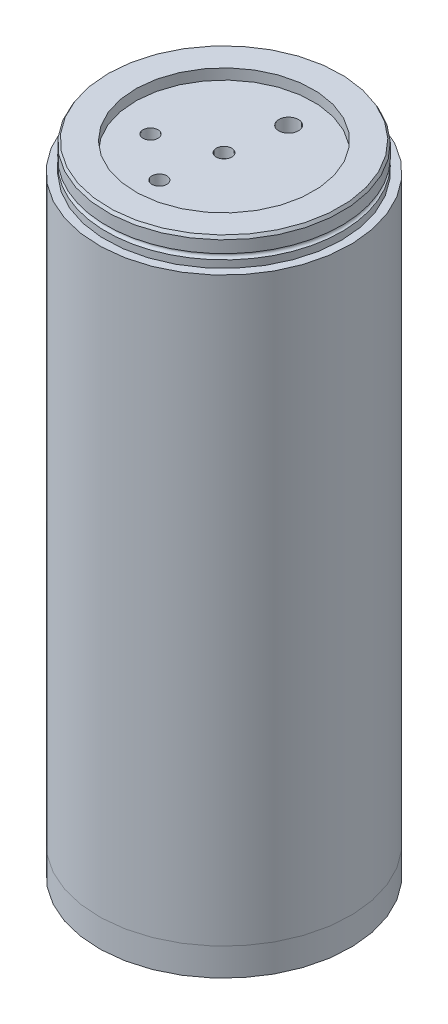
SolidWorks part; units mm, degrees
ref_plane "Front Plane" through (0, 0, 0) normal (0, 0, 1) x (1, 0, 0)
ref_plane "Top Plane" through (0, 0, 0) normal (0, 1, 0) x (1, 0, 0)
ref_plane "Right Plane" through (0, 0, 0) normal (1, 0, 0) x (0, 0, -1)
imported_body "Delrin Compute HousingPart-1-solid1"
imported_body "Delrin Compute HousingPart-1-solid2"
imported_body "Delrin Compute HousingPart-1-solid3"
imported_body "Delrin Compute HousingPart-1-solid4"
imported_body "ComputeNodeHousingPart-1-solid1"
imported_body "ComputeNodeHousingPart-1-solid2"
imported_body "ComputeNodeHousingPart-1-solid3"
imported_body "ComputeNodeHousingPart-1-solid4"
combine bodies "Combine2" operation type add bodies to combine 105 106 108 102 101 103 104
